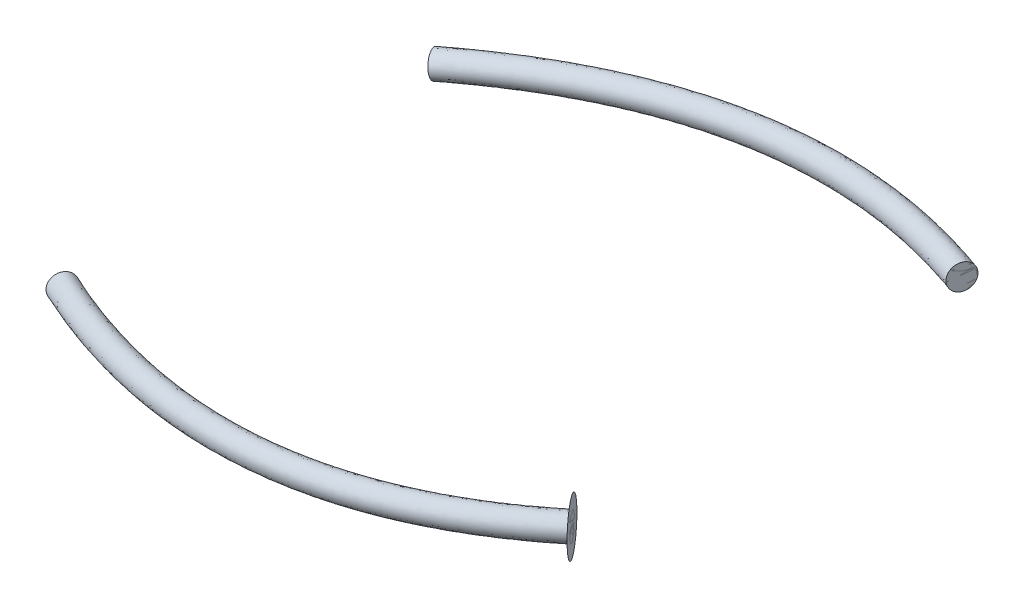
SolidWorks part; units mm, degrees
ref_plane "Ebene vorne" through (0, 0, 0) normal (0, 0, 1) x (1, 0, 0)
ref_plane "Ebene oben" through (0, 0, 0) normal (0, 1, 0) x (1, 0, 0)
ref_plane "Ebene rechts" through (0, 0, 0) normal (1, 0, 0) x (0, 0, -1)
sketch3d "3D-Skizze_A1"
  spline S0 degree 2 poles (-0.5249, 0, -14.7565) (25.9708, 4.6739, -26.8679) (50.6299, 4.5378, -11.4248) knots 0 0 0 1 1 1
sketch3d "3D-Skizze_B1"
  spline S0 degree 2 poles (0.063, 0, 15.8164) (32.4078, 2.9351, 32.2093) (52.7268, 2.8594, 0.2761) knots 0 0 0 1 1 1
ref_plane "Ebene_A1" through (-0.5249, 0, -14.7565) normal (0.898, 0.1584, -0.4105) x (-0.4042, -0.0713, -0.9119)
sketch "Skizze_A1" plane through (-0.5249, 0, -14.7565) normal (0.898, 0.1584, -0.4105) x (-0.4042, -0.0713, -0.9119)
  circle A0 centre (0, 0) radius 1
  dimension "D1" = 2
sweep "Austragung_A1" add profiles "Skizze_A1" path "3D-Skizze_A1"
ref_plane "Ebene_B1" through (0.063, 0, 15.8164) normal (0.8891, 0.0807, 0.4506) x (0.449, 0.0381, -0.8927)
sketch "Skizze_B1" plane through (0.063, 0, 15.8164) normal (0.8891, 0.0807, 0.4506) x (0.449, 0.0381, -0.8927)
  circle A0 centre (0, 0) radius 1
  dimension "D1" = 2
sweep "Austragung_B1" add profiles "Skizze_B1" path "3D-Skizze_B1"
ref_plane "Ebene_AB2" through (40, 0, 0) normal (1, 0, 0) x (0, 0, -1)
sketch "Skizze_AB2" plane through (40, 0, 0) normal (1, 0, 0) x (0, 0, -1)
  point P0 (16.7694, 4.3761)
  point P25 (-14.6806, 2.6524)
ref_plane "Ebene_A3" through (40, 4.3761, -16.7694) normal (0.9339, 0.0333, 0.356) x (0.3558, 0.0127, -0.9345)
sketch "SkizzeA2" plane through (40, 4.3761, -16.7694) normal (0.9339, 0.0333, 0.356) x (0.3558, 0.0127, -0.9345)
  spline S0 degree 3 poles (1.0156, -0.1959) (0.9887, 0.1996) (0.954, 0.3272) (0.8374, 0.562) (0.7558, 0.6677) (0.5591, 0.8392) (0.4428, 0.906) (0.1959, 0.9892) (0.0629, 1.0065) (-0.1974, 0.989) (-0.3264, 0.9543) (-0.5612, 0.838) (-0.6662, 0.7573) (-0.8399, 0.5585) (-0.9057, 0.4437) (-0.9895, 0.1951) (-1.0065, 0.0628) (-0.9889, -0.1976) (-0.9539, -0.3271) (-0.8382, -0.5606) (-0.7564, -0.6669) (-0.5601, -0.8386) (-0.4443, -0.9054) (-0.1962, -0.9893) (-0.0648, -1.0066) (0.1983, -0.989) (0.3261, -0.9544) (0.5614, -0.8379) (0.6669, -0.7565) (0.9247, -0.4615) (1.0156, -0.1959) (0.9887, 0.1996) (0.954, 0.3272) knots -0.125 -0.125 0 0 0.0625 0.0625 0.125 0.125 0.1875 0.1875 0.25 0.25 0.3125 0.3125 0.375 0.375 0.4375 0.4375 0.5 0.5 0.5625 0.5625 0.625 0.625 0.6875 0.6875 0.75 0.75 0.8125 0.8125 0.875 0.875 1 1 1.0625 1.0625 1.125 only from (0.9976, 0.0678) to (0.9976, 0.0678)
  spline S1 degree 3 poles (1.0156, -0.1959) (0.9887, 0.1996) (0.954, 0.3272) (0.8374, 0.562) (0.7558, 0.6677) (0.5591, 0.8392) (0.4428, 0.906) (0.1959, 0.9892) (0.0629, 1.0065) (-0.1974, 0.989) (-0.3264, 0.9543) (-0.5612, 0.838) (-0.6662, 0.7573) (-0.8399, 0.5585) (-0.9057, 0.4437) (-0.9895, 0.1951) (-1.0065, 0.0628) (-0.9889, -0.1976) (-0.9539, -0.3271) (-0.8382, -0.5606) (-0.7564, -0.6669) (-0.5601, -0.8386) (-0.4443, -0.9054) (-0.1962, -0.9893) (-0.0648, -1.0066) (0.1983, -0.989) (0.3261, -0.9544) (0.5614, -0.8379) (0.6669, -0.7565) (0.9247, -0.4615) (1.0156, -0.1959) (0.9887, 0.1996) (0.954, 0.3272) knots -0.125 -0.125 0 0 0.0625 0.0625 0.125 0.125 0.1875 0.1875 0.25 0.25 0.3125 0.3125 0.375 0.375 0.4375 0.4375 0.5 0.5 0.5625 0.5625 0.625 0.625 0.6875 0.6875 0.75 0.75 0.8125 0.8125 0.875 0.875 1 1 1.0625 1.0625 1.125 only from (0.9976, 0.0678) to (0.9976, 0.0678)
surface "Oberfläche-Ebene_A1" sketch "SkizzeA2"
other "Oberflächenschnitt_A1"
ref_plane "Ebene_B3" through (40, 2.6524, 14.6806) normal (0.7973, 0.0266, -0.6029) x (-0.6026, -0.0201, -0.7978)
sketch "SkizzeB2" plane through (40, 2.6524, 14.6806) normal (0.7973, 0.0266, -0.6029) x (-0.6026, -0.0201, -0.7978)
  circle A0 centre (0, 0) radius 2
  point P0 (0, 0)
  dimension "D1" = 4
surface "Oberfläche-Ebene_B1" sketch "SkizzeB2"
other "Oberflächenschnitt_B1"
equation "\"Durchmesser\"= 2.0"
equation "\"D1@Skizze_A1\" = \"Durchmesser\""
equation "\"D1@Skizze_B1\" = \"Durchmesser\""
equation "\"D1@SkizzeB2\" = 2*\"Durchmesser\""
